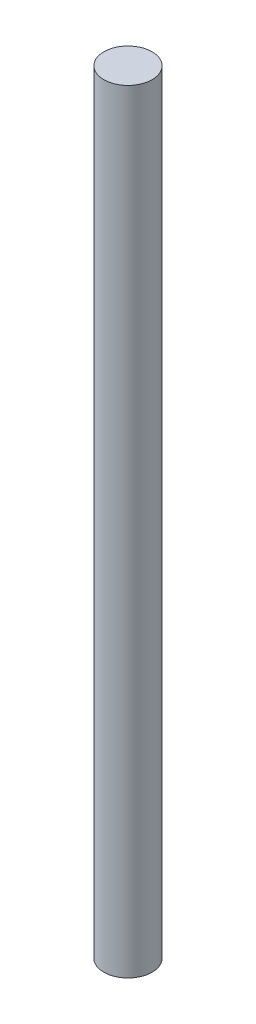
SolidWorks part; units mm, degrees
ref_plane "Front Plane" through (0, 0, 0) normal (0, 0, 1) x (1, 0, 0)
ref_plane "Top Plane" through (0, 0, 0) normal (0, 1, 0) x (1, 0, 0)
ref_plane "Right Plane" through (0, 0, 0) normal (1, 0, 0) x (0, 0, -1)
sketch "Sketch1" plane through (0, 0, 0) normal (0, 1, 0) x (1, 0, 0)
  circle A0 centre (0, 0) radius 3.175
extrude "Boss-Extrude2" add sketch "Sketch1" along normal blind 101.6
